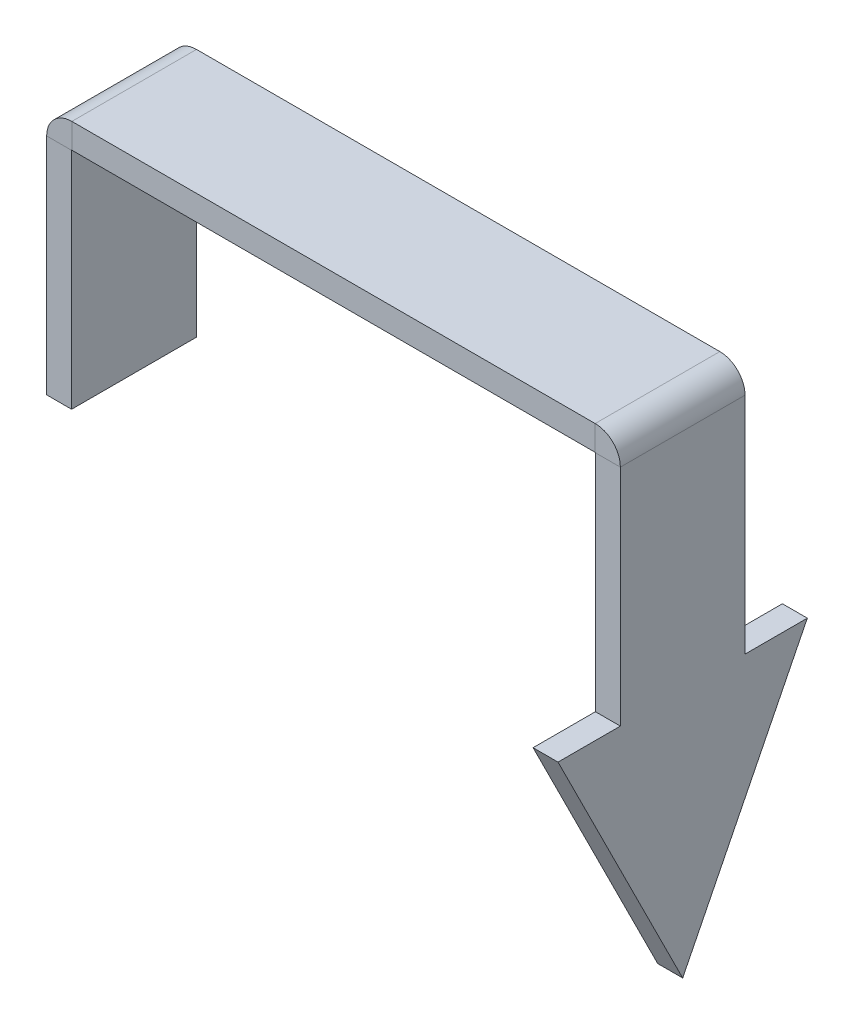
SolidWorks part; units mm, degrees
ref_plane "Front" through (0, 0, 0) normal (0, 0, 1) x (1, 0, 0)
ref_plane "Top" through (0, 0, 0) normal (0, 1, 0) x (1, 0, 0)
ref_plane "Right" through (0, 0, 0) normal (1, 0, 0) x (0, 0, -1)
sketch "Sketch1" plane through (0, 0, 0) normal (0, 1, 0) x (1, 0, 0)
  line L0 (-10, 2.5) -> (-10, -2.5)
  line L1 (-10, -2.5) -> (33, -2.5)
  line L2 (-10, 2.5) -> (33, 2.5)
  line L4 (33, 5) -> (33, 2.5)
  line L6 (33, -5) -> (43, 0)
  line L8 (33, -2.5) -> (33, -5)
  line L10 (43, 0) -> (33, 5)
sheet metal parameters "Sheet-Metal1" thickness 1 parameters "D1"=0.01
base flange "Base-Flange1" sketch "Sketch1" thickness 1 reverse thickness direction yes parameters "D1"=0.01
sketch "Sketch3" plane through (0, 1, 0) normal (0, 1, 0) x (-1, 0, 0)
  line L1 (0, 2.5) -> (0, -2.5)
  line L2 (-23, 2.5) -> (-23, -2.5)
sketched bend "Sketched Bend1" parameters "D1"=0.01
bend "SketchBend1" bend radius 0.01 bend angle 90 parameters "D5"=1
bend "SketchBend2" bend radius 0 bend angle 90 parameters "D5"=2
flat pattern "Flat-Pattern1"
sketch "Bend-Lines1" plane through (0, 0, 0) normal (0, 1, 0) x (-1, 0, 0)
bend of the flat pattern "Flatten-<SketchBend1>1"
bend of the flat pattern "Flatten-<SketchBend2>1"
